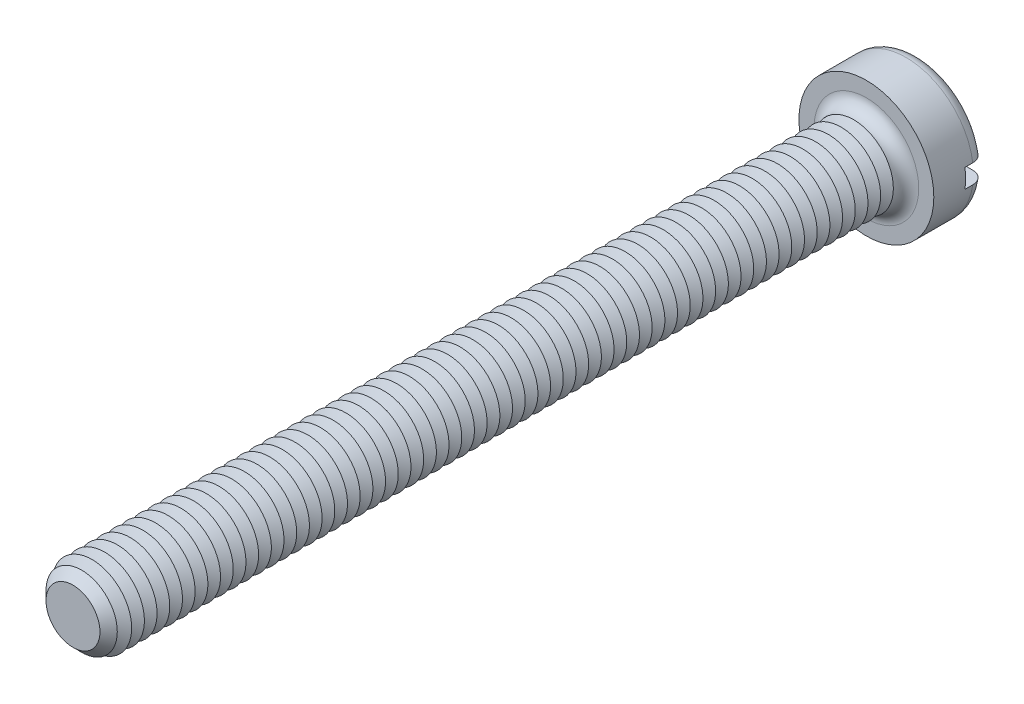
SolidWorks part; units mm, degrees
ref_plane "Front Plane" through (0, 0, 0) normal (0, 0, 1) x (1, 0, 0)
ref_plane "Top Plane" through (0, 0, 0) normal (0, 1, 0) x (1, 0, 0)
ref_plane "Right Plane" through (0, 0, 0) normal (1, 0, 0) x (0, 0, -1)
sketch "Sketch3" plane through (0, 0, 0) normal (0, 0, 1) x (1, 0, 0)
  circle A0 centre (0, 0) radius 4.25
  dimension "D1" = 8.5
extrude "Boss-Extrude2" add sketch "Sketch3" against normal blind 3.3
sketch "Sketch4" plane through (0, 0, 0) normal (0, 0, 1) x (1, 0, 0)
  circle A0 centre (0, 0) radius 2.5
  dimension "D1" = 5
extrude "Boss-Extrude3" add sketch "Sketch4" along normal blind 50
fillet "Fillet1" radius 0.8 2 edges at (4.25, 0, -3.3) (2.5, 0, 0)
chamfer "Chamfer1" distance 0.8 angle 45 1 edges at (2.5, 0, 50)
sketch "Sketch5" plane through (0, 0, 0) normal (1, 0, 0) x (0, 0, -1)
  line L0 (1.6944, 0) -> (-7.6738, 0) construction
sketch "Sketch6" plane through (0, 0, 0) normal (1, 0, 0) x (0, 0, -1)
  line L0 (-0.8, 2.5) -> (-1.2, 1.8072)
  line L1 (-1.2, 1.8072) -> (-1.6, 2.5)
  line L2 (-0.8, 2.5) -> (-49.2, 2.5) construction
  line L3 (-1.6, 2.5) -> (-0.8, 2.5)
  dimension "D1" = 0.8
revolve "Cut-Revolve1" cut sketch "Sketch6" angle 360 about L0
pattern_linear "LPattern1" count 61 spacing 0.8 along (0, 0, 1) of "Cut-Revolve1"
sketch "Sketch8" plane through (0, 0, -3.3) normal (0, 0, -1) x (-1, 0, 0)
  line L1 (4.25, -0.6) -> (-4.25, -0.6)
  line L2 (4.25, -0.6) -> (4.25, 0.6)
  line L3 (4.25, 0.6) -> (-4.25, 0.6)
  line L4 (-4.25, -0.6) -> (-4.25, 0.6)
  line L5 (4.25, -0.6) -> (-4.25, 0.6) construction
  line L6 (4.25, 0.6) -> (-4.25, -0.6) construction
  point P0 (0, 0)
  dimension "D1" = 8.5
  dimension "D2" = 1.2
extrude "Cut-Extrude1" cut sketch "Sketch8" against normal blind 1.3
